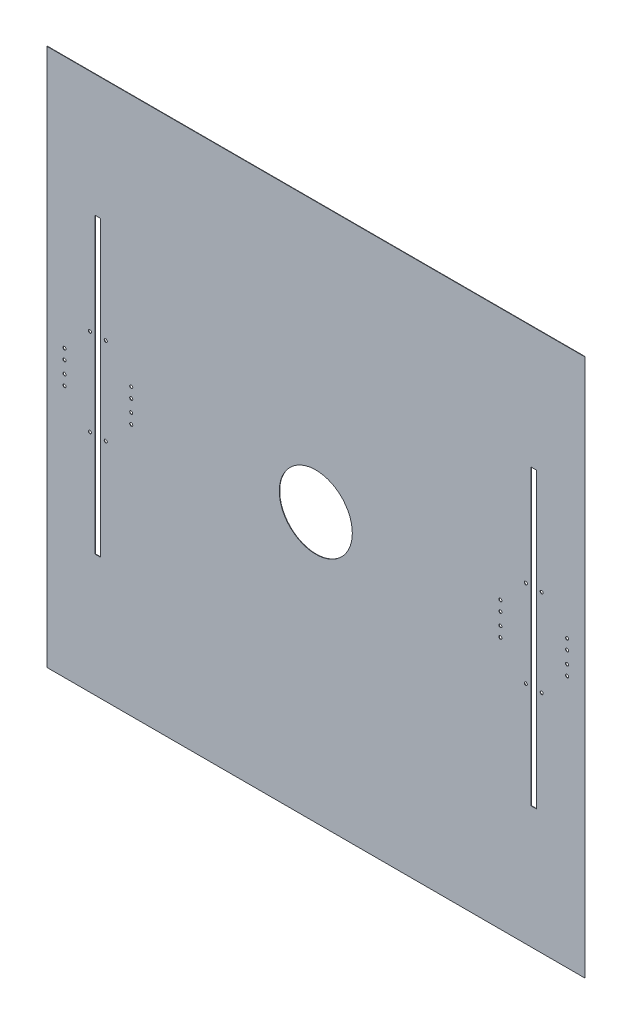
SolidWorks part; units mm, degrees
ref_plane "Front Plane" through (0, 0, 0) normal (0, 0, 1) x (1, 0, 0)
ref_plane "Top Plane" through (0, 0, 0) normal (0, 1, 0) x (1, 0, 0)
ref_plane "Right Plane" through (0, 0, 0) normal (1, 0, 0) x (0, 0, -1)
sketch "Sketch1" plane through (0, 0, 0) normal (0, 0, 1) x (1, 0, 0)
  line L0 (3018.0596, -3.9433) -> (3018.0596, -1832.7433) construction
  line L1 (-16.6672, 758.0567) -> (3336.1328, 758.0567)
  line L2 (-16.6672, 758.0567) -> (-16.6672, -2594.7433)
  line L3 (-16.6672, -2594.7433) -> (3336.1328, -2594.7433)
  line L4 (3336.1328, 758.0567) -> (3336.1328, -2594.7433)
  line L6 (283.5152, -3.9433) -> (319.4362, -3.9433)
  line L7 (3336.1328, 758.0567) -> (-16.6672, -2594.7433) construction
  line L8 (3336.1328, -2594.7433) -> (-16.6672, 758.0567) construction
  line L9 (283.5152, -3.9433) -> (283.5152, -1832.7433)
  line L10 (283.5152, -1832.7433) -> (319.4362, -1832.7433)
  line L11 (319.4362, -3.9433) -> (319.4362, -1832.7433)
  line L12 (3000.0991, -1832.7433) -> (3036.0201, -1832.7433)
  line L13 (3000.0991, -1832.7433) -> (3000.0991, -3.9433)
  line L14 (3000.0991, -3.9433) -> (3036.0201, -3.9433)
  line L15 (3036.0201, -1832.7433) -> (3036.0201, -3.9433)
  circle A0 centre (252.2632, -646.9076) radius 9.525
  circle A1 centre (350.6882, -646.9076) radius 9.525
  circle A2 centre (509.4382, -816.7433) radius 9.6752
  circle A3 centre (93.5132, -816.7433) radius 9.525
  circle A4 centre (93.5132, -880.2433) radius 9.525
  circle A5 centre (93.5132, -956.4433) radius 9.525
  circle A6 centre (93.5132, -1019.9433) radius 9.525
  circle A7 centre (252.2632, -1189.7791) radius 9.525
  circle A8 centre (350.6882, -1189.7791) radius 9.525
  circle A9 centre (509.4382, -1019.9433) radius 9.525
  circle A10 centre (509.4382, -956.4433) radius 9.525
  circle A11 centre (509.4382, -880.2433) radius 9.525
  circle A12 centre (3226.0221, -816.7433) radius 9.525
  circle A13 centre (3226.0221, -880.2433) radius 9.525
  circle A14 centre (3226.0221, -956.4433) radius 9.525
  circle A15 centre (3226.0221, -1019.9433) radius 9.525
  circle A16 centre (2810.0971, -1019.9433) radius 9.525
  circle A17 centre (2810.0971, -956.4433) radius 9.525
  circle A18 centre (2810.0971, -880.2433) radius 9.525
  circle A19 centre (2810.0971, -816.7433) radius 9.525
  circle A20 centre (2968.8471, -646.9076) radius 9.525
  circle A21 centre (3067.2721, -646.9076) radius 9.525
  circle A22 centre (2968.8471, -1189.7791) radius 9.525
  circle A23 centre (3067.2721, -1189.7791) radius 9.525
  circle A24 centre (1659.7328, -918.3433) radius 227.582
  point P4 (1659.7328, 758.0567)
  point P6 (3336.1328, -918.3433)
  point P9 (3018.0596, -918.3433)
  dimension "D1" = 3352.8
  dimension "D2" = 3352.8
extrude "Boss-Extrude1" add sketch "Sketch1" against normal blind 2.54
